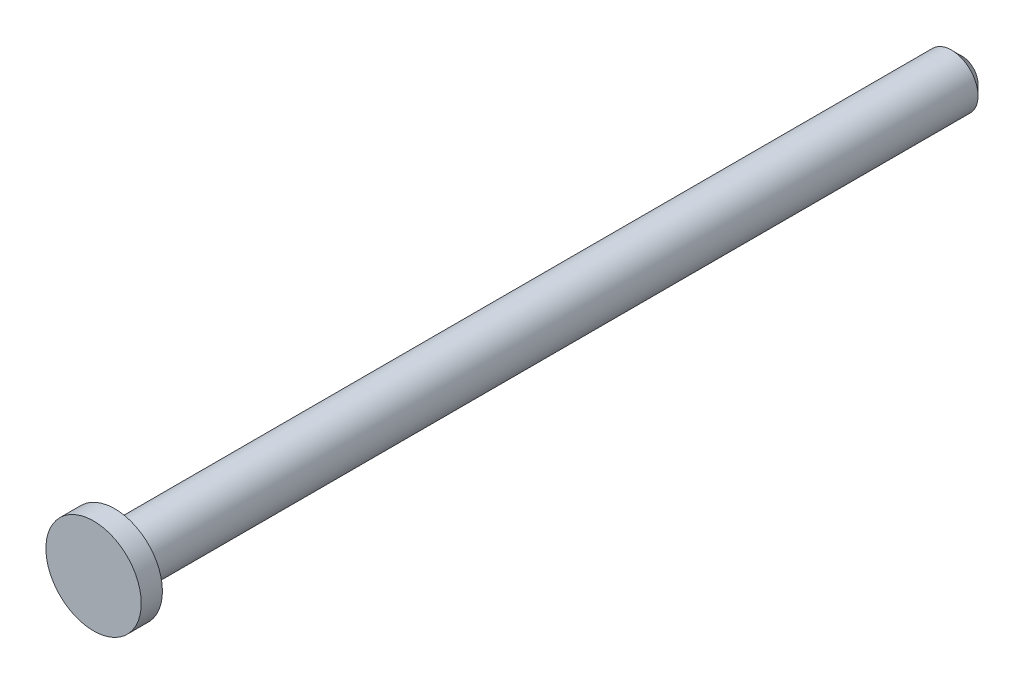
SolidWorks part; units mm, degrees
ref_plane "Front Plane" through (0, 0, 0) normal (0, 0, 1) x (1, 0, 0)
ref_plane "Top Plane" through (0, 0, 0) normal (0, 1, 0) x (1, 0, 0)
ref_plane "Right Plane" through (0, 0, 0) normal (1, 0, 0) x (0, 0, -1)
sketch "Sketch1" plane through (0, 0, 0) normal (0, 0, 1) x (1, 0, 0)
  circle A0 centre (0, 0) radius 3.175
  dimension "D1" = 6.35
extrude "Boss-Extrude1" add sketch "Sketch1" along normal mid plane 101.6
sketch "Sketch2" plane through (0, 0, 50.8) normal (0, 0, 1) x (1, 0, 0)
  circle A0 centre (0, 0) radius 5.715
  circle A1 centre (0, 0) radius 3.175 construction
  dimension "D1" = 2.54
extrude "Boss-Extrude2" add sketch "Sketch2" along normal blind 2.54
chamfer "Chamfer1" distance 1.27 angle 45 1 edges at (3.175, 0, -50.8)
